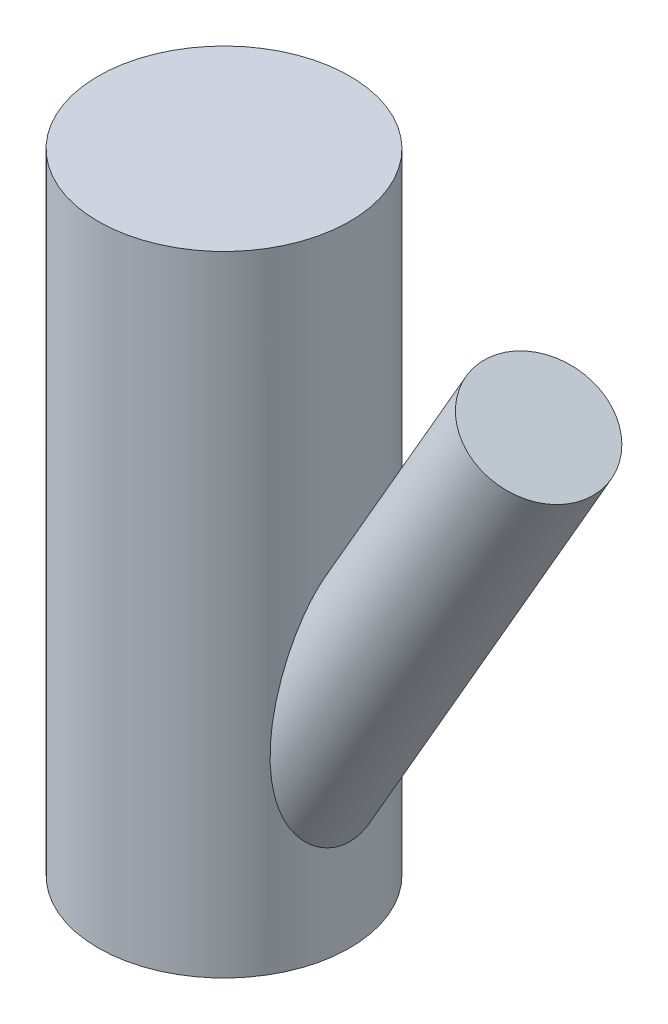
SolidWorks part; units mm, degrees
ref_plane "Front Plane" through (0, 0, 0) normal (0, 0, 1) x (1, 0, 0)
ref_plane "Top Plane" through (0, 0, 0) normal (0, 1, 0) x (1, 0, 0)
ref_plane "Right Plane" through (0, 0, 0) normal (1, 0, 0) x (0, 0, -1)
sketch "Sketch3" plane through (0, 0, 0) normal (0, 1, 0) x (1, 0, 0)
  circle A0 centre (0, 0) radius 10
  dimension "D1" = 20
extrude "Extrude1" add sketch "Sketch3" along normal blind 50
sketch "Sketch2" plane through (0, 0, 0) normal (0, 0, 1) x (1, 0, 0)
  line L0 (0, 0) -> (25, 43.3013) construction
  line L1 (25, 43.3013) -> (20.6699, 45.8013)
  line L2 (20.6699, 45.8013) -> (0.6699, 11.1603)
  line L3 (0.6699, 11.1603) -> (5, 8.6603)
  line L4 (5, 8.6603) -> (25, 43.3013)
  line L6 (-10, 0) -> (10, 0) construction
  dimension "D1" = 60
  dimension "D2" = 5
  dimension "D3" = 40
  dimension "D4" = 10
revolve "Revolve1" add sketch "Sketch2" angle 360 about L0
